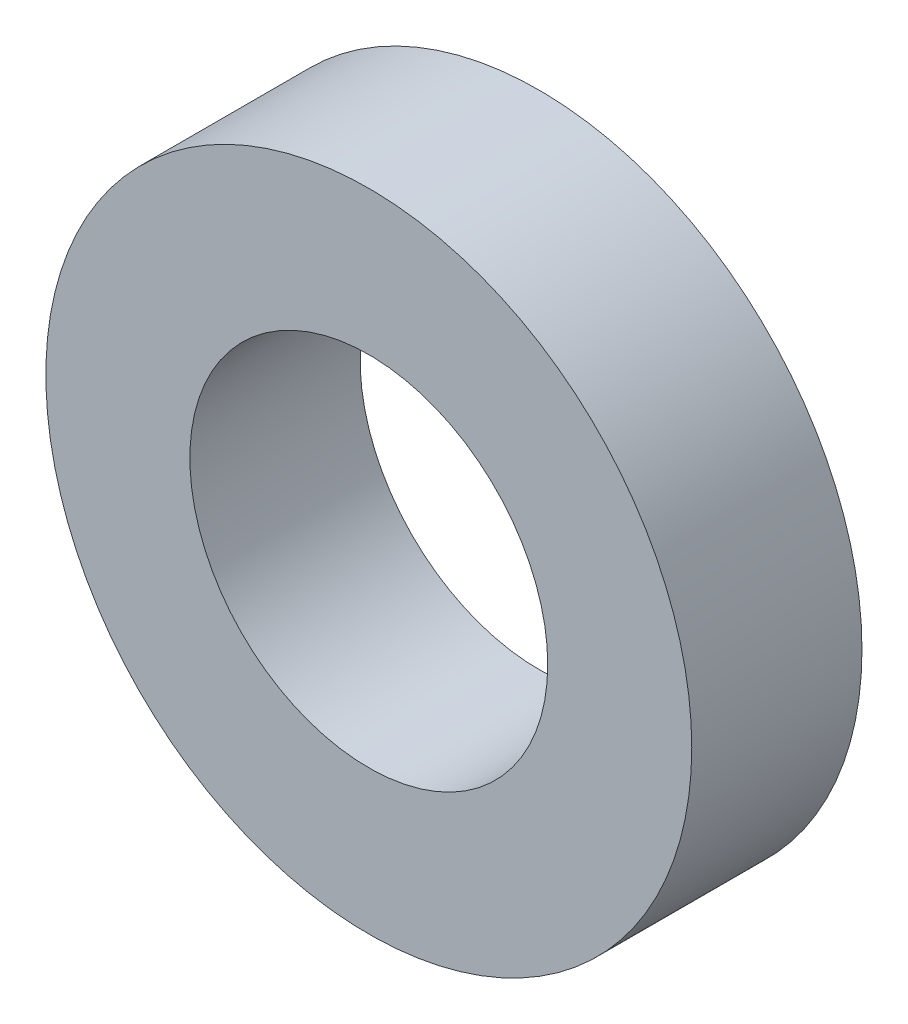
SolidWorks part; units mm, degrees
ref_plane "Plan de face" through (0, 0, 0) normal (0, 0, 1) x (1, 0, 0)
ref_plane "Plan de dessus" through (0, 0, 0) normal (0, 1, 0) x (1, 0, 0)
ref_plane "Plan de droite" through (0, 0, 0) normal (1, 0, 0) x (0, 0, -1)
sketch "Esquisse1" plane through (0, 0, 0) normal (1, 0, 0) x (0, 0, -1)
  line L0 (0, 0) -> (63.6337, 0) construction
  line L2 (0, 4.1) -> (3.9, 4.1)
  line L3 (0, 4.1) -> (0, 7.4)
  line L4 (0, 7.4) -> (3.9, 7.4)
  line L5 (3.9, 4.1) -> (3.9, 7.4)
  dimension "D1" = 8.2
  dimension "D2" = 14.8
  dimension "D3" = 3.9
revolve "Révolution2" add sketch "Esquisse1" angle 360 about L0
